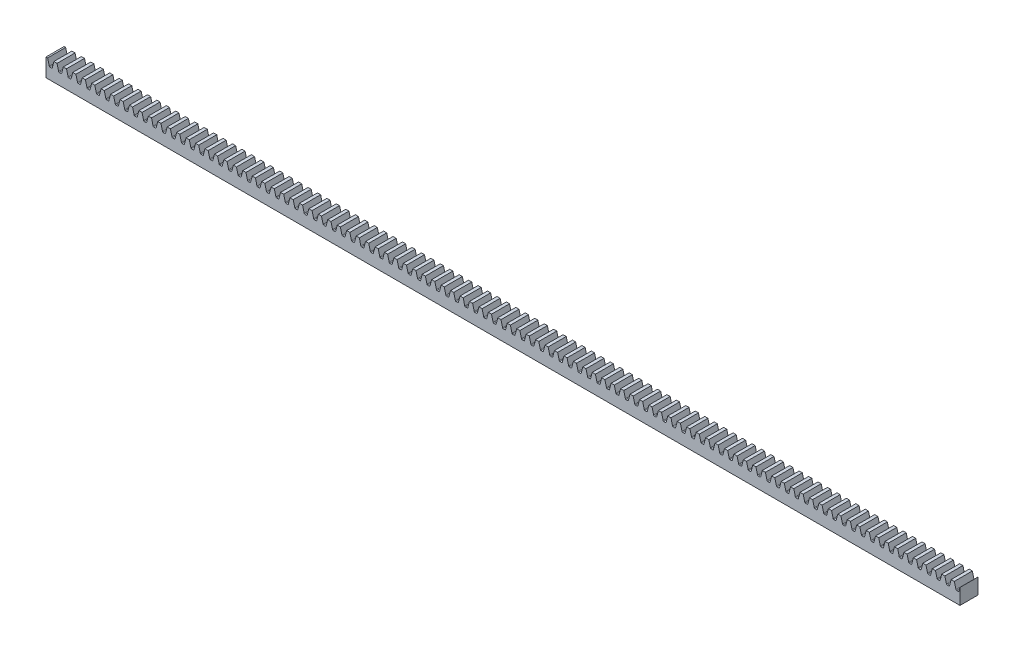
SolidWorks part; units mm, degrees
ref_plane "Front" through (0, 0, 0) normal (0, 0, 1) x (1, 0, 0)
ref_plane "Top" through (0, 0, 0) normal (0, 1, 0) x (1, 0, 0)
ref_plane "Right" through (0, 0, 0) normal (1, 0, 0) x (0, 0, -1)
sketch "Sketch1" plane through (0, 0, 0) normal (0, 0, 1) x (1, 0, 0)
  line L0 (-120.65, 0) -> (692.15, 0) construction
  line L1 (-120.65, -2.3813) -> (120.65, -2.3813)
  line L2 (-120.65, -2.3813) -> (-120.65, 2.3813)
  line L3 (-120.65, 2.3813) -> (120.65, 2.3813)
  line L4 (120.65, -2.3813) -> (120.65, 2.3813)
  line L5 (-120.65, -2.3813) -> (120.65, 2.3813) construction
  line L6 (-120.65, 2.3813) -> (120.65, -2.3813) construction
  point P0 (0, 0)
extrude "Boss-Extrude1" add sketch "Sketch1" along normal mid plane 4.7625
sketch "Sketch2" plane through (0, 0, 2.3813) normal (0, 0, 1) x (1, 0, 0)
  line L0 (-120.2319, 2.3813) -> (-119.7671, 0.5842)
  line L1 (120.65, 2.3813) -> (-120.65, 2.3813) construction
  line L2 (-119.7671, 0.5842) -> (-119.0392, 0.5842)
  line L3 (-119.0392, 0.5842) -> (-118.5745, 2.3813)
  line L4 (-120.2319, 2.3813) -> (-118.5745, 2.3813)
  line L5 (-120.0266, 1.5875) -> (-117.5329, 1.5875) construction
  line L6 (-118.5745, 2.3813) -> (-117.7382, 2.3813) construction
  line L7 (-118.7798, 0.5842) -> (-118.7798, 2.3813) construction
  line L8 (-119.4032, 2.3813) -> (-119.4032, 0.5842) construction
  line L10 (-117.7382, 2.3813) -> (-117.2735, 0.5842) construction
  line L11 (-117.5329, 2.3813) -> (-117.5329, 0.5842) construction
  line L12 (-120.2319, 2.3813) -> (-120.65, 2.3813) construction
  point P7 (-118.7798, 1.5875)
  point P14 (-120.0266, 1.5875)
extrude "Cut-Extrude1" cut sketch "Sketch2" against normal blind 4.7625
fillet "Fillet3" radius 0.182 2 edges at (-119.0392, 0.5842, 0) (-119.7671, 0.5842, 0)
pattern_linear "LPattern4" count 238 spacing 2.4936 along (1, 0, 0) of "Cut-Extrude1", "Fillet3"
sketch "Ref" plane through (0, 0, 2.3813) normal (0, 0, 1) x (1, 0, 0)
  line L0 (-120.65, 1.5875) -> (120.65, 1.5875) construction
  line L1 (-120.65, -2.3813) -> (-120.65, 2.3813) construction
  line L2 (120.65, -2.3813) -> (120.65, 2.3813) construction
  line L3 (-120.0266, 1.5875) -> (-117.5329, 1.5875) construction
equation "\"D1@Sketch2\" = 1/\"Diamteral Pitch@Sketch1\""
equation "\"D3@Sketch2\" = 3.1416/\"Diamteral Pitch@Sketch1\""
equation "\"D4@Sketch2\" = (2.2/\"Diamteral Pitch@Sketch1\")+.002"
equation "\"D3@LPattern4\" =\"D3@Sketch2\""
equation "\"D1@Fillet3\" = \"D9@Sketch2\"*.25"
equation "\"D1@LPattern4\" = \"RackLength\" * 25"
equation "\"D1@Cut-Extrude1\" = \"D1@Boss-Extrude1\""
equation "\"D8@Sketch2\" = \"D5@Sketch2\"*.5"
equation "\"D1@Sketch1\" = \"RackLength\""
equation "\"RackLength\" = 9.5in"
